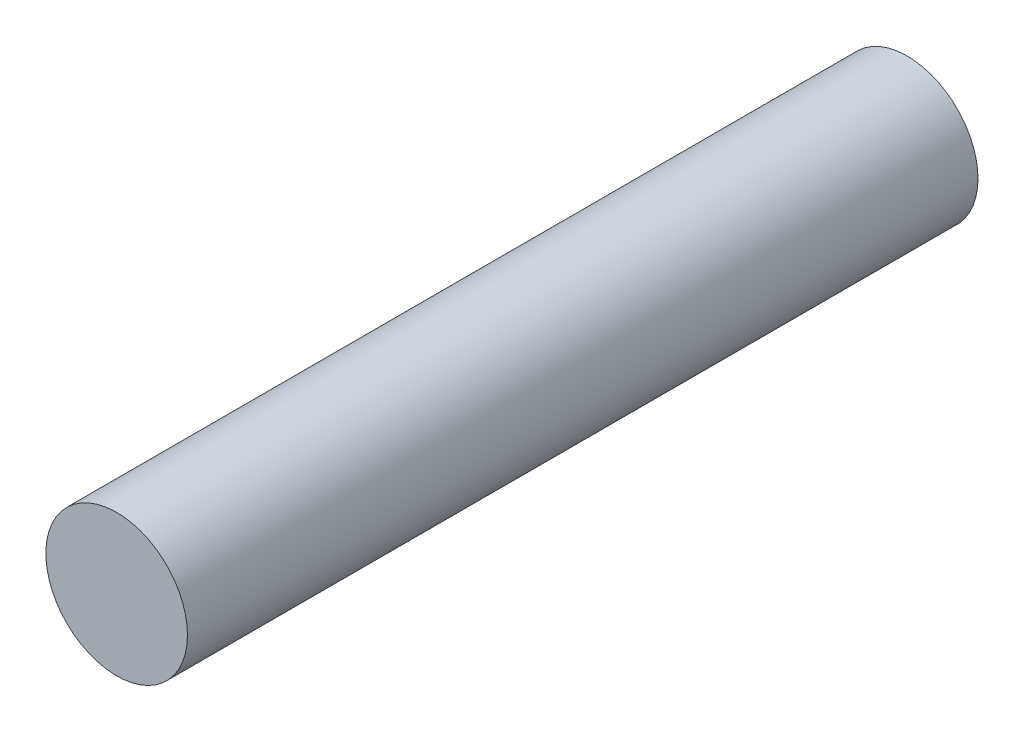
SolidWorks part; units mm, degrees
ref_plane "Front Plane" through (0, 0, 0) normal (0, 0, 1) x (1, 0, 0)
ref_plane "Top Plane" through (0, 0, 0) normal (0, 1, 0) x (1, 0, 0)
ref_plane "Right Plane" through (0, 0, 0) normal (1, 0, 0) x (0, 0, -1)
sketch "Sketch1" plane through (0, 0, 0) normal (0, 0, 1) x (1, 0, 0)
  circle A0 centre (0, 0) radius 0.985
  dimension "D1" = 1.97
extrude "Boss-Extrude1" add sketch "Sketch1" along normal blind 11
